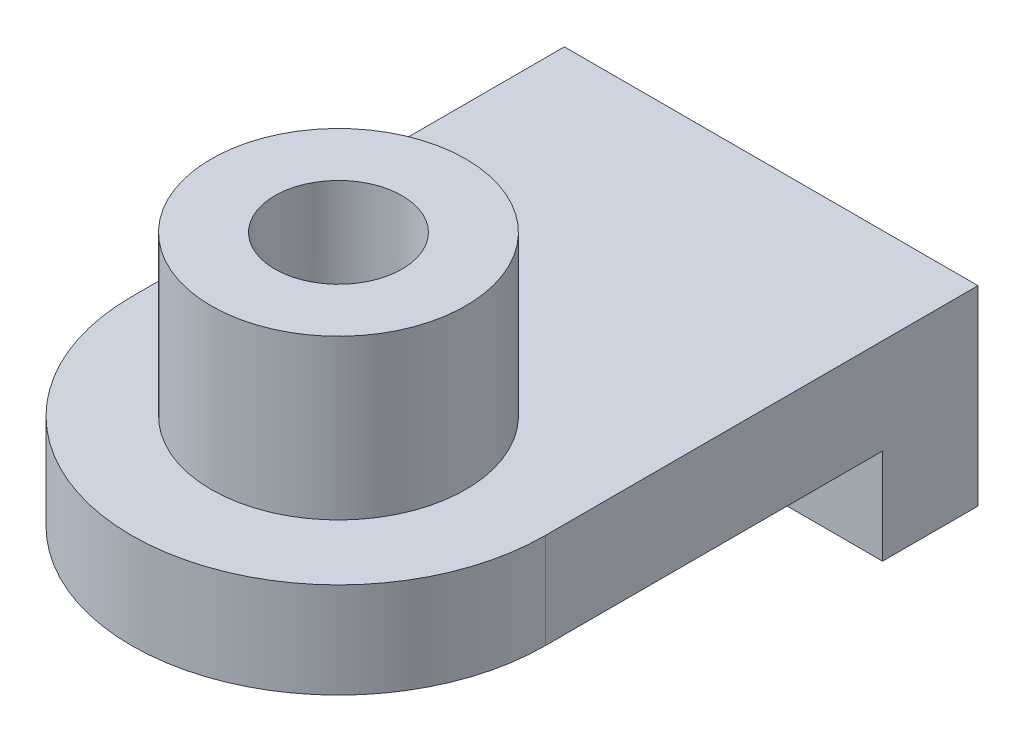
SolidWorks part; units mm, degrees
ref_plane "Plane1" through (0, 0, 0) normal (0, 0, 1) x (1, 0, 0)
ref_plane "Plane2" through (0, 0, 0) normal (0, 1, 0) x (1, 0, 0)
ref_plane "Plane3" through (0, 0, 0) normal (1, 0, 0) x (0, 0, -1)
sketch "Sketch1" plane through (0, 0, 0) normal (0, 1, 0) x (1, 0, 0)
  line L0 (32.5, 0) -> (32.5, 68)
  line L2 (-32.5, 68) -> (-32.5, 0)
  line L3 (-32.5, 68) -> (32.5, 68)
  arc A0 (32.5, 0) -> (-32.5, 0) centre (0, 0) cw
  dimension "D1" = 65
  dimension "D2" = 68
extrude "Base-Extrude" add sketch "Sketch1" along normal blind 15
sketch "Sketch2" plane through (32.5, 0, 0) normal (1, 0, 0) x (0, 0, -1)
  line L0 (68, 0) -> (53, 0)
  line L1 (68, 0) -> (68, -15)
  line L2 (53, -15) -> (68, -15)
  line L3 (53, -15) -> (53, 0)
  line L4 (0, 0) -> (68, 0) construction
  dimension "D1" = 15
  dimension "D2" = 15
extrude "Boss-Extrude1" add sketch "Sketch2" against normal through all
sketch "Sketch3" plane through (0, 15, 0) normal (0, 1, 0) x (-1, 0, 0)
  circle A0 centre (0, 0) radius 20
  dimension "D1" = 40
extrude "Boss-Extrude2" add sketch "Sketch3" along normal blind 25
hole_wizard "Hole1" positions "Sketch5" profile "Sketch4" legacy
sketch "Sketch5" plane through (0, 40, 0) normal (0, 1, 0) x (-1, 0, 0)
  circle A0 centre (0, 0) radius 20 construction
  point P0 (0, 0)
sketch "Sketch4" plane through (0, 40, 0) normal (1, 0, 0) x (0, 0, 1)
  line L0 (0, 0) -> (0, 25)
  line L1 (0, 25) -> (10, 25)
  line L2 (10, 25) -> (10, 0)
  line L3 (10, 0) -> (0, 0)
  line L4 (0, 110) -> (0, -10) construction
  dimension "Diameter" = 20
  dimension "Depth" = 25
